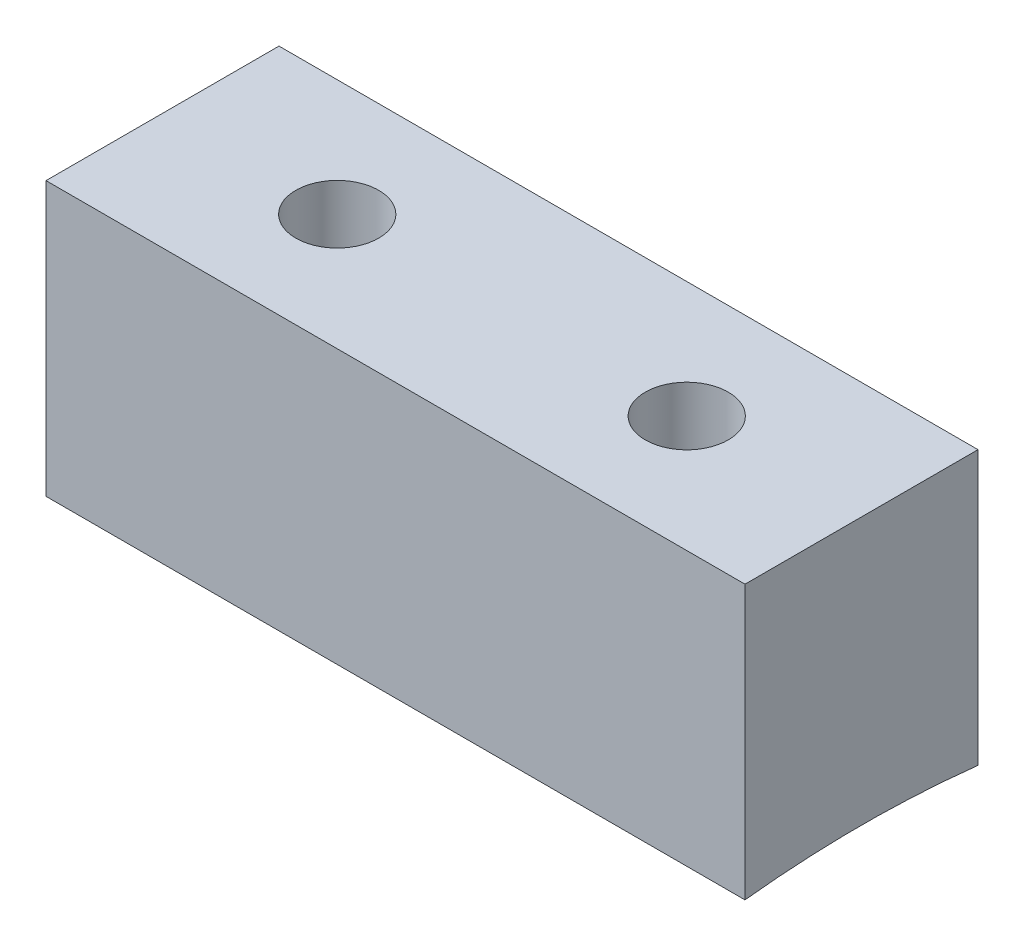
SolidWorks part; units mm, degrees
ref_plane "Front" through (0, 0, 0) normal (0, 0, 1) x (1, 0, 0)
ref_plane "Top" through (0, 0, 0) normal (0, 1, 0) x (1, 0, 0)
ref_plane "Right" through (0, 0, 0) normal (1, 0, 0) x (0, 0, -1)
sketch "Sketch1" plane through (0, 0, 0) normal (0, 0, 1) x (1, 0, 0)
  line L1 (0, 0) -> (-19.05, 0)
  line L2 (0, 0) -> (0, 7.4524)
  line L3 (0, 7.4524) -> (-19.05, 7.4524)
  line L4 (-19.05, 0) -> (-19.05, 7.4524)
  dimension "D1" = 19.05
  dimension "D2" = 7.4524
extrude "Extrude1" add sketch "Sketch1" along normal blind 6.35
hole_wizard "#4-40 Tapped Hole1" positions "3DSketch1" profile "Sketch4" tap size "#4-40" standard "Ansi Inch"
sketch3d "3DSketch1"
  line L3 (-9.525, 7.4524, 0) -> (-9.525, 7.4524, 6.35) construction
  line L4 (0, 7.4524, 0) -> (-19.05, 7.4524, 0) construction
  line L5 (0, 7.4524, 6.35) -> (-19.05, 7.4524, 6.35) construction
  line L6 (-9.525, 7.4524, 3.175) -> (0, 7.4524, 3.175) construction
  line L7 (0, 7.4524, 6.35) -> (0, 7.4524, 0) construction
  line L8 (-9.525, 7.4524, 3.175) -> (-19.05, 7.4524, 3.175) construction
  line L9 (-19.05, 7.4524, 6.35) -> (-19.05, 7.4524, 0) construction
  point P8 (-4.7625, 7.4524, 3.175)
  point P10 (-14.2875, 7.4524, 3.175)
  point P40 (-14.2875, 7.4524, 3.175)
  point P42 (-4.7625, 7.4524, 3.175)
sketch "Sketch4" plane through (-14.2875, 7.4524, 3.175) normal (1, 0, 0) x (0, 0, 1)
  line L0 (0, 0) -> (0, 7.4524)
  line L1 (0, 7.4524) -> (1.1303, 7.4524)
  line L2 (1.1303, 7.4524) -> (1.1303, 0)
  line L5 (1.1303, 0) -> (0, 0)
  line L11 (0, -6.35) -> (0, 107.95) construction
  dimension "Thru Tap Drill Dia." = 2.2606
  dimension "Thru Tap Drill Depth" = 7.4524
sketch "Sketch2" plane through (0, 0, 0) normal (1, 0, 0) x (0, 0, -1)
  line L0 (-3.175, 7.4524) -> (-3.175, -28.3981) construction
  line L1 (-6.35, 7.4524) -> (0, 7.4524) construction
  circle A0 centre (-3.175, -28.3981) radius 28.575
  dimension "D1" = 57.15
extrude "Cut-Extrude1" cut sketch "Sketch2" against normal through all
